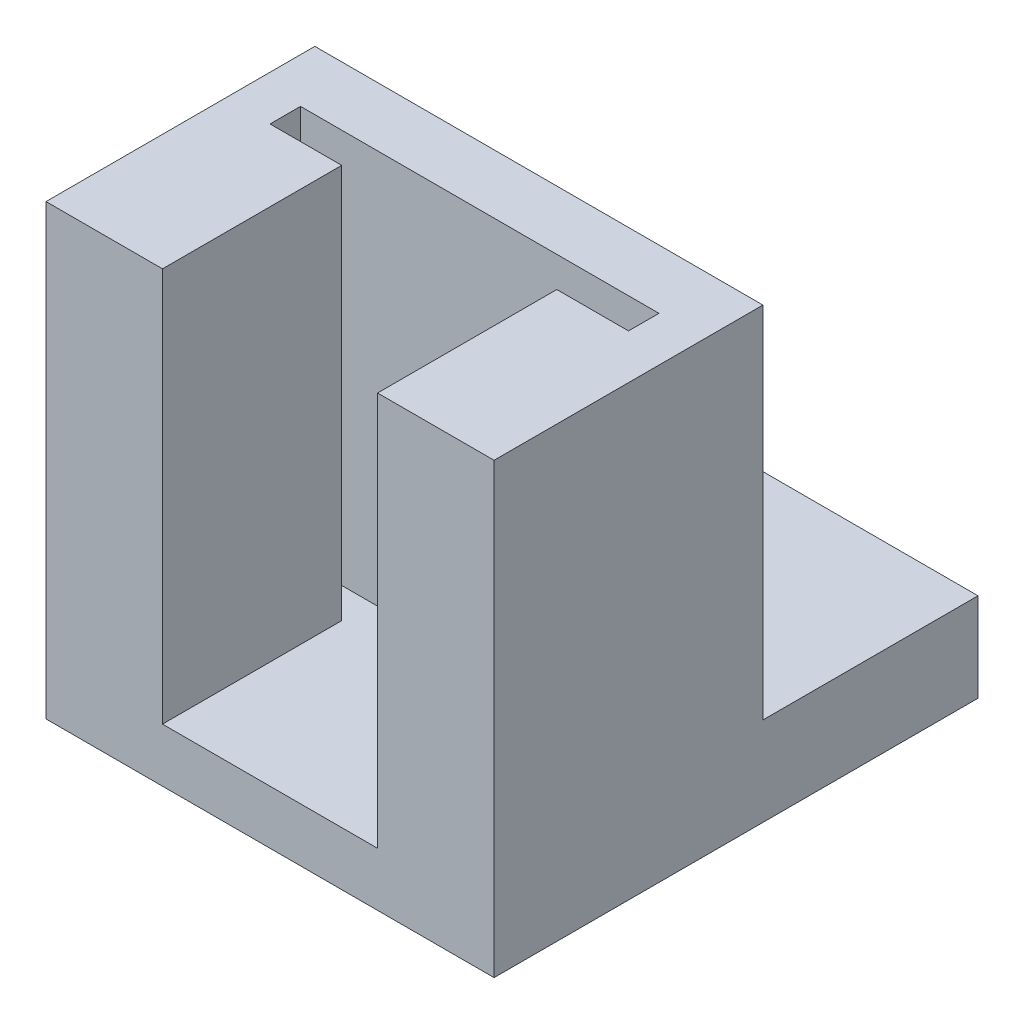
SolidWorks part; units mm, degrees
ref_plane "Front Plane" through (0, 0, 0) normal (0, 0, 1) x (1, 0, 0)
ref_plane "Top Plane" through (0, 0, 0) normal (0, 1, 0) x (1, 0, 0)
ref_plane "Right Plane" through (0, 0, 0) normal (1, 0, 0) x (0, 0, -1)
sketch "Sketch1" plane through (0, 0, 0) normal (0, 0, 1) x (1, 0, 0)
  line L1 (-12.5, -12.5) -> (12.5, -12.5)
  line L2 (-12.5, -12.5) -> (-12.5, 12.5)
  line L3 (-12.5, 12.5) -> (12.5, 12.5)
  line L4 (12.5, -12.5) -> (12.5, 12.5)
  line L5 (-12.5, -12.5) -> (12.5, 12.5) construction
  line L6 (-12.5, 12.5) -> (12.5, -12.5) construction
  point P0 (0, 0)
  dimension "D1" = 25
  dimension "D2" = 25
extrude "Boss-Extrude1" add sketch "Sketch1" along normal blind 15
sketch "Sketch2" plane through (0, 12.5, 0) normal (0, 1, 0) x (1, 0, 0)
  line L1 (6, -15) -> (-6, -15)
  line L3 (-6, -15) -> (-6, -5)
  line L5 (6, -15) -> (6, -5)
  line L7 (-10, -5) -> (-6, -5)
  line L8 (-10, -3.3) -> (10, -3.3)
  line L9 (10, -5) -> (10, -3.3)
  line L10 (-10, -5) -> (-10, -3.3)
  line L11 (6, -5) -> (10, -5)
  dimension "D1" = 10
  dimension "D2" = 12
  dimension "D3" = 1.7
  dimension "D4" = 20
extrude "Cut-Extrude1" cut sketch "Sketch2" against normal blind 22
sketch "Sketch3" plane through (0, 0, 0) normal (0, 0, -1) x (-1, 0, 0)
  line L0 (-12.5, -12.5) -> (-12.5, -7.5481)
  line L1 (-12.5, -12.5) -> (12.5, -12.5)
  line L2 (-12.5, -7.5481) -> (12.5, -7.5481)
  line L3 (12.5, -12.5) -> (12.5, -7.5481)
  line L4 (-12.5, -12.5) -> (-12.5, 12.5) construction
  dimension "D1" = 25
extrude "Boss-Extrude2" add sketch "Sketch3" along normal blind 12
